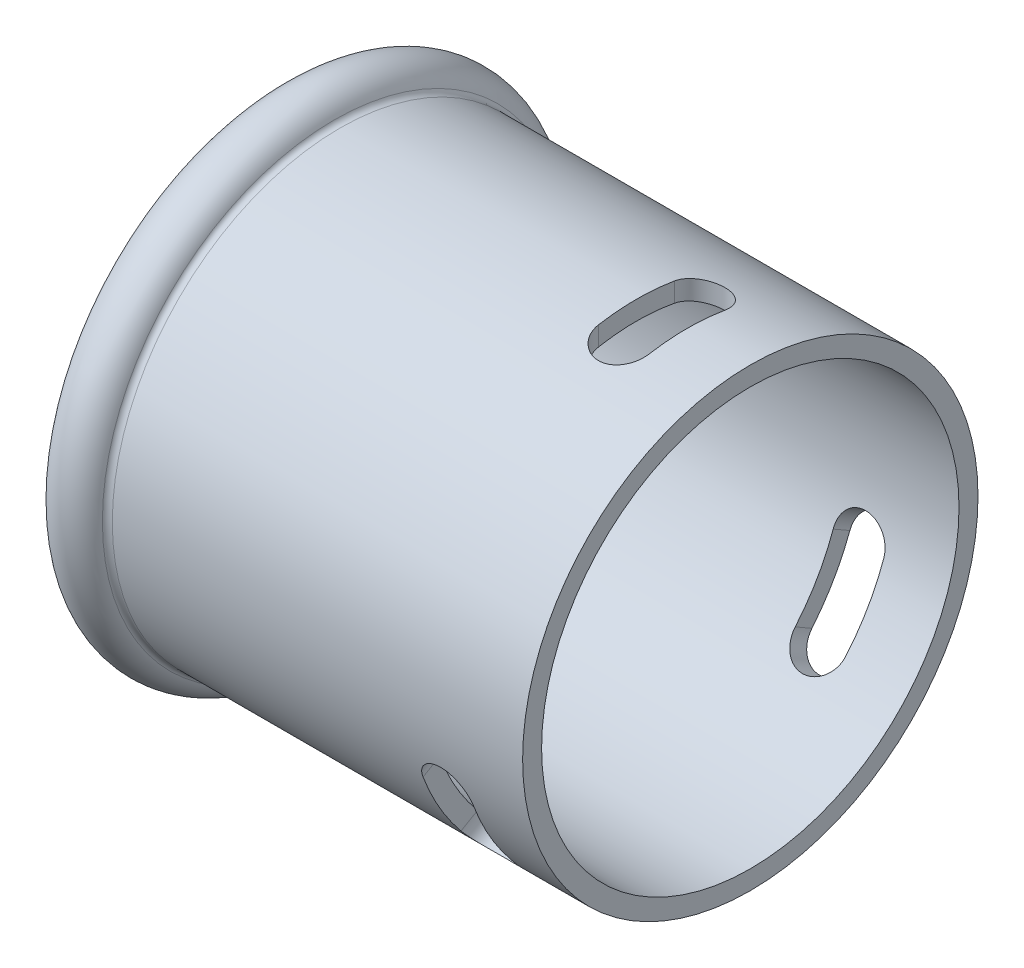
SolidWorks part; units mm, degrees
ref_plane "Plan1" through (0, 0, 0) normal (0, 0, 1) x (1, 0, 0)
ref_plane "Plan2" through (0, 0, 0) normal (0, 1, 0) x (1, 0, 0)
ref_plane "Plan3" through (0, 0, 0) normal (1, 0, 0) x (0, 0, -1)
sketch "Esquisse1" plane through (0, 0, 0) normal (0, 0, 1) x (1, 0, 0)
  line L1 (6.9457, 17.5) -> (6.9457, 17)
  line L2 (6.9457, 17) -> (5.4457, 17)
  line L3 (5.4457, 17.5) -> (5.4457, 17)
  line L4 (10.6597, 0) -> (56.6597, 0) construction
  line L5 (42.6957, 18) -> (10.2574, 18)
  line L7 (42.6957, 16.5) -> (8.8413, 16.5)
  line L8 (42.6957, 18) -> (42.6957, 16.5)
  line L10 (50, 0) -> (-50, 0) construction
  arc A0 (8.3831, 17.2) -> (6.9457, 17.5) centre (7.6957, 17.5) ccw
  arc A1 (9.7917, 18.3182) -> (5.4457, 17.5) centre (7.6957, 17.5) ccw
  arc A2 (9.7917, 18.3182) -> (10.2574, 18) centre (10.2574, 18.5) ccw
  arc A3 (8.3831, 17.2) -> (8.8413, 16.5) centre (8.8413, 17) ccw
  dimension "D1" = 1.5
  dimension "D2" = 4.5
  dimension "D4" = 0.5
  dimension "D7" = 0.5
  dimension "D3" = 18
  dimension "D5" = 35
  dimension "D6" = 1.5
revolve "Base-Révolution" add sketch "Esquisse1" angle 360 about L4
sketch "Esquisse2" plane through (0, 0, 0) normal (0, 1, 0) x (1, 0, 0)
  line L0 (47, 0) -> (14, 0) construction
  line L1 (10.6597, 0) -> (56.6597, 0) construction
  line L2 (42.6957, -18) -> (42.6957, 18) construction
  line L4 (33.6957, -3) -> (33.6957, 3)
  line L6 (37.6957, -3) -> (37.6957, 3)
  arc A0 (37.6957, 3) -> (33.6957, 3) centre (35.6957, 3) ccw
  arc A1 (37.6957, -3) -> (33.6957, -3) centre (35.6957, -3) cw
  dimension "D1" = 6
  dimension "D2" = 4
  dimension "D3" = 5
extrude "Enlèv. mat.-Extru.1" cut sketch "Esquisse2" along normal blind 20
pattern_circular "Répétition circulaire1" count 3 every 120 about axis through (10.6597, 0, 0) along (1, 0, 0)
